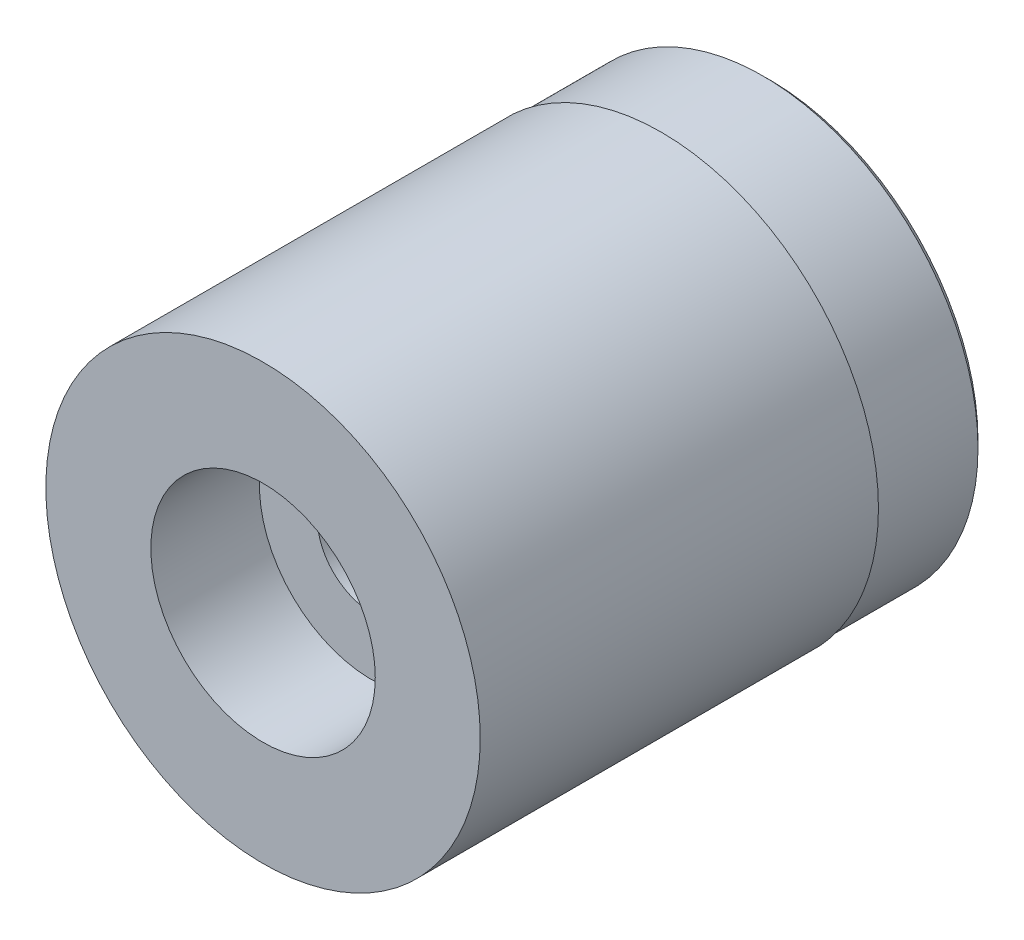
SolidWorks part; units mm, degrees
ref_plane "Front Plane" through (0, 0, 0) normal (0, 0, 1) x (1, 0, 0)
ref_plane "Top Plane" through (0, 0, 0) normal (0, 1, 0) x (1, 0, 0)
ref_plane "Right Plane" through (0, 0, 0) normal (1, 0, 0) x (0, 0, -1)
sketch "Sketch1" plane through (0, 0, 0) normal (1, 0, 0) x (0, 0, -1)
  line L2 (0, 6) -> (0, 3.1)
  line L3 (13.75, 6) -> (0, 6)
  line L4 (-3.7979, 0) -> (49996.2021, 0) construction
  line L8 (14, 1.5) -> (3, 1.5)
  line L9 (3, 3.1) -> (3, 1.5)
  line L10 (3, 3.1) -> (0, 3.1)
  line L12 (14, 1.5) -> (14, 5.75)
  line L16 (14, 5.75) -> (13.75, 6)
  dimension "D1" = 14
  dimension "D2" = 45
  dimension "D3" = 0.25
  dimension "D4" = 12
  dimension "D5" = 6.2
  dimension "D6" = 3
  dimension "D7" = 3
revolve "Revolve1" add sketch "Sketch1" angle 360 about L4
sketch "Sketch4" plane through (0, 0, 0) normal (1, 0, 0) x (0, 0, -1)
  line L0 (0, 0) -> (50000, 0) construction
  line L1 (14, -5.75) -> (14, 5.75) construction
  line L2 (11, 6.935) -> (14, 6.935)
  line L3 (11, 6.935) -> (11, 5.935)
  line L4 (11, 5.935) -> (14, 5.935)
  line L5 (14, 6.935) -> (14, 5.935)
  line L6 (13.75, 6) -> (0, 6) construction
  line L9 (0, 6.6) -> (0, -6.6) construction
  dimension "D1" = 1
  dimension "D2" = 0.065
  dimension "D3" = 11
revolve "Cut-Revolve1" cut sketch "Sketch4" angle 360 about L0
